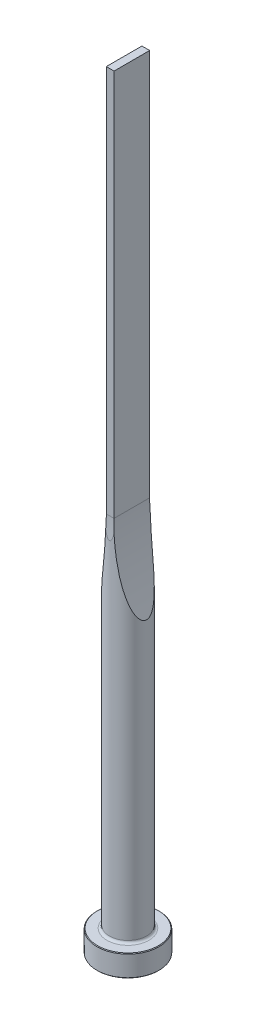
SolidWorks part; units mm, degrees
ref_plane "Front Plane" through (0, 0, 0) normal (0, 0, 1) x (1, 0, 0)
ref_plane "Top Plane" through (0, 0, 0) normal (0, 1, 0) x (1, 0, 0)
ref_plane "Right Plane" through (0, 0, 0) normal (1, 0, 0) x (0, 0, -1)
sketch "Sketch1" plane through (0, 0, 0) normal (0, 0, 1) x (1, 0, 0)
  line L0 (0, 0) -> (9.8, 0)
  line L1 (55, 0) -> (-55, 0) construction
  line L2 (10, 0.2) -> (10, 6.8)
  line L3 (9.8, 7) -> (6.8, 7)
  line L4 (6, 7.8) -> (6, 250)
  line L5 (0, 250) -> (6, 250)
  line L6 (10, 6.8) -> (9.8, 7)
  line L7 (9.8, 0) -> (10, 0.2)
  line L8 (0, 250) -> (0, 0)
  arc A0 (6, 7.8) -> (6.8, 7) centre (6.8, 7.8) ccw
  point P1 (10, 0)
  point P6 (10, 7)
  dimension "D4" = 0.8
  dimension "D1" = 6
  dimension "D2" = 10
  dimension "D3" = 7
  dimension "D5" = 250
revolve "Revolve1" add sketch "Sketch1" angle 360 about L8
sketch "Sketch2" plane through (0, 0, 0) normal (0, 0, 1) x (1, 0, 0)
  line L0 (1.25, 250) -> (1.25, 125)
  line L1 (6, 250) -> (-6, 250) construction
  line L2 (-1.25, 250) -> (-1.25, 125)
  line L3 (6, 250) -> (6, 96.148)
  line L4 (-6, 250) -> (-6, 96.148)
  line L5 (0, -11) -> (0, 11) construction
  line L6 (6, 250) -> (1.25, 250)
  line L8 (-1.25, 250) -> (-6, 250)
  arc A0 (1.25, 125) -> (6, 96.148) centre (91.25, 125) ccw
  arc A1 (-1.25, 125) -> (-6, 96.148) centre (-91.25, 125) cw
  dimension "D4" = 90
  dimension "D1" = 125
  dimension "D2" = 2.5
  dimension "D3" = 1.25
extrude "Cut-Extrude1" cut sketch "Sketch2" against normal mid plane 15
sketch "Sketch3" plane through (0, 0, 0) normal (1, 0, 0) x (0, 0, -1)
  line L0 (5.75, 250) -> (5.75, 125)
  line L1 (-5.8683, 250) -> (5.8683, 250) construction
  line L2 (-5.75, 250) -> (-5.75, 125)
  line L3 (6, 250) -> (6, 118.2965)
  line L4 (5.75, 250) -> (6, 250)
  line L5 (0, 11) -> (0, -11) construction
  line L6 (-6, 250) -> (-6, 118.2965)
  line L8 (-5.75, 250) -> (-6, 250)
  arc A0 (5.75, 125) -> (6, 118.2965) centre (95.75, 125) ccw
  arc A1 (-5.75, 125) -> (-6, 118.2965) centre (-95.75, 125) cw
  dimension "D2" = 90
  dimension "D1" = 125
  dimension "D3" = 11.5
  dimension "D4" = 5.75
extrude "Cut-Extrude2" cut sketch "Sketch3" against normal mid plane 15
